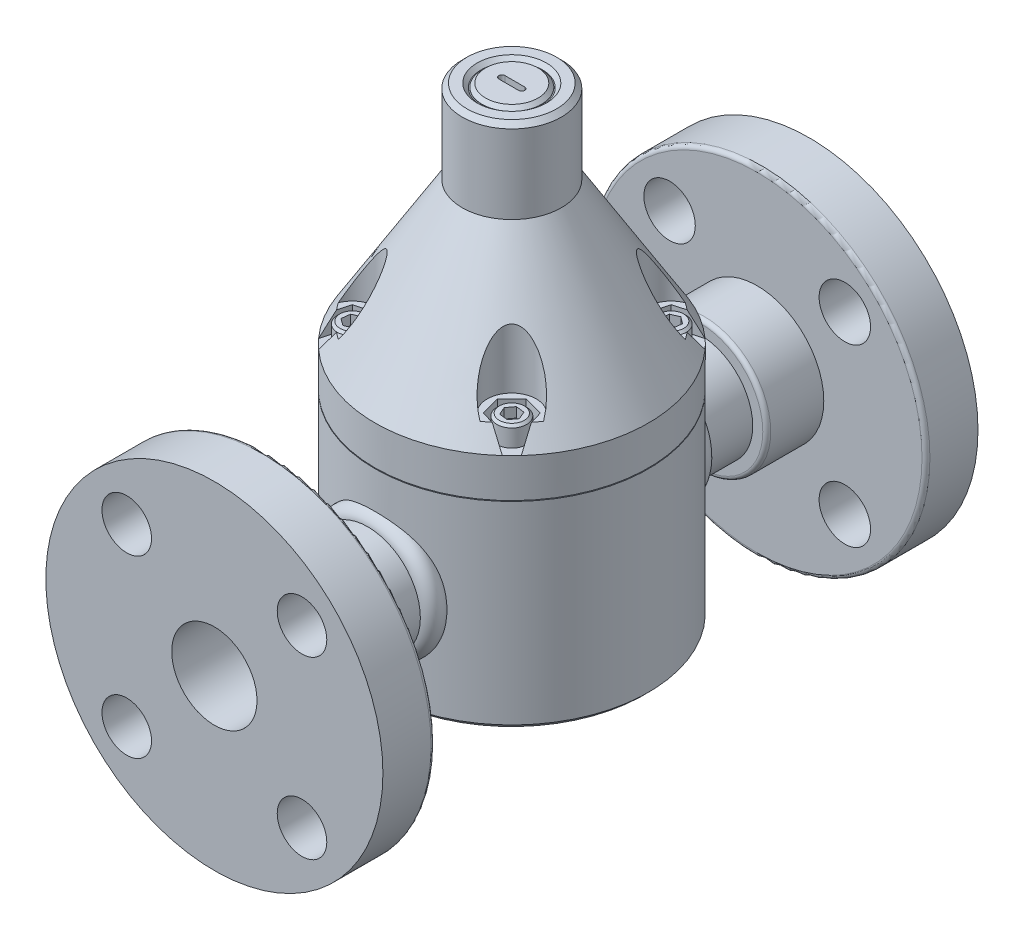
SolidWorks part; units mm, degrees
ref_plane "Front Plane" through (0, 0, 0) normal (0, 0, 1) x (1, 0, 0)
ref_plane "Top Plane" through (0, 0, 0) normal (0, 1, 0) x (1, 0, 0)
ref_plane "Right Plane" through (0, 0, 0) normal (1, 0, 0) x (0, 0, -1)
sketch "Sketch1" plane through (0, 0, 0) normal (0, 1, 0) x (1, 0, 0)
  circle A0 centre (0, 0) radius 43.815
  dimension "D1" = 87.63
extrude "Extrude1" add sketch "Sketch1" along normal blind 148.59
sketch "Sketch2" plane through (0, 0, 0) normal (0, 0, 1) x (1, 0, 0)
  line L0 (0, 148.59) -> (0, 0) construction
  line L1 (43.815, 148.59) -> (-43.815, 148.59) construction
  line L2 (-52.6288, 63.5) -> (-30.226, 63.5)
  line L4 (-30.226, 63.5) -> (-30.226, 63.754)
  line L5 (-30.226, 63.754) -> (-43.815, 63.754)
  line L7 (-43.815, 63.754) -> (-43.815, 76.2)
  line L8 (-43.815, 76.2) -> (-15.875, 121.92)
  line L9 (-15.875, 121.92) -> (-15.875, 152.4)
  line L10 (-15.875, 152.4) -> (-52.6288, 152.4)
  line L11 (-52.6288, 152.4) -> (-52.6288, 63.5)
  line L12 (-43.815, 0) -> (43.815, 0) construction
  dimension "D1" = 43.815
  dimension "D2" = 15.875
  dimension "D3" = 63.5
  dimension "D4" = 30.226
  dimension "D5" = 0.254
  dimension "D6" = 76.2
  dimension "D7" = 152.4
  dimension "D8" = 121.92
revolve "Cut-Revolve1" cut sketch "Sketch2" angle 360 about L0
chamfer "Chamfer1" distance 1.524 angle 45 2 edges at (0, 0, 43.815) (0, 148.59, 15.875)
ref_plane "Plane1" through (0, 148.59, 0) normal (0, 1, 0) x (-1, 0, 0)
sketch "Sketch3" plane through (0, 148.59, 0) normal (0, 1, 0) x (-1, 0, 0)
  circle A0 centre (0, 0) radius 11.1125
  dimension "D1" = 22.225
extrude "Extrude2" cut sketch "Sketch3" against normal blind 1.27 draft 45
sketch "Sketch4" plane through (0, 148.59, 0) normal (0, 1, 0) x (-1, 0, 0)
  circle A0 centre (0, 0) radius 9.525
  dimension "D1" = 19.05
extrude "Extrude3" add sketch "Sketch4" against normal up to surface (1.27 mm away)
chamfer "Chamfer2" distance 1.143 angle 45 1 edges at (0, 148.59, 9.525)
sketch "Sketch5" plane through (0, 148.59, 0) normal (0, 1, 0) x (-1, 0, 0)
  line L0 (3.175, 0) -> (-3.175, 0) construction
  line L1 (3.175, 0.9652) -> (-3.175, 0.9652)
  line L2 (-3.175, -0.9652) -> (3.175, -0.9652)
  arc A0 (-3.175, 0.9652) -> (-3.175, -0.9652) centre (-3.175, 0) ccw
  arc A1 (3.175, -0.9652) -> (3.175, 0.9652) centre (3.175, 0) ccw
  dimension "D1" = 3.175
  dimension "D2" = 6.35
  dimension "D3" = 0.9652
  dimension "D4" = 0.9652
extrude "Extrude4" cut sketch "Sketch5" against normal blind 3.175 draft 1
ref_plane "Plane2" through (0, 82.55, 0) normal (0, 1, 0) x (-1, 0, 0)
sketch "Sketch6" plane through (0, 82.55, 0) normal (0, 1, 0) x (-1, 0, 0)
  line L0 (0, 0) -> (-30.9819, 30.9819) construction
  circle A0 centre (0, 0) radius 36.0934 construction
  circle A1 centre (0, 0) radius 43.815 construction
  circle A2 centre (-25.5219, 25.5219) radius 7.874
  dimension "D1" = 15.748
extrude "Extrude5" cut sketch "Sketch6" along normal blind 22.86
sketch "Sketch7" plane through (0, 82.55, 0) normal (0, 1, 0) x (-1, 0, 0)
  line L0 (0, 0) -> (-25.5219, 25.5219) construction
  line L1 (-25.5219, 25.5219) -> (-31.0896, 19.9541) construction
  line L2 (-25.5219, 25.5219) -> (-19.9541, 31.0896) construction
  line L3 (-25.5219, 25.5219) -> (-39.3911, 39.3911) construction
  line L4 (-30.0845, 20.9593) -> (-23.8519, 19.2893)
  line L5 (-23.8519, 19.2893) -> (-19.2893, 23.8519)
  line L6 (-19.2893, 23.8519) -> (-20.9593, 30.0845)
  line L10 (-30.0845, 20.9593) -> (-33.6536, 33.6536)
  line L11 (-33.6536, 33.6536) -> (-20.9593, 30.0845)
  line L13 (-27.1919, 31.7545) -> (-31.7545, 27.1919)
  line L14 (-20.9593, 30.0845) -> (-27.1919, 31.7545)
  line L15 (-31.7545, 27.1919) -> (-30.0845, 20.9593)
  arc A0 (-32.8666, 22.6837) -> (-22.6837, 32.8666) centre (-25.5219, 25.5219) ccw construction
  circle A1 centre (-25.5219, 25.5219) radius 5.588 construction
extrude "Extrude6" cut sketch "Sketch7" against normal blind 6.35
sketch "Sketch8" plane through (0, 82.55, 0) normal (0, 1, 0) x (-1, 0, 0)
  circle A0 centre (-25.5219, 25.5219) radius 4.7625
  dimension "D1" = 9.525
extrude "Extrude7" add sketch "Sketch8" against normal up to surface (6.35 mm away)
sketch "Sketch9" plane through (0, 82.55, 0) normal (0, 1, 0) x (-1, 0, 0)
  line L1 (-23.8739, 27.7452) -> (-26.6233, 28.0608)
  line L2 (-26.6233, 28.0608) -> (-28.2713, 25.8375)
  line L3 (-28.2713, 25.8375) -> (-27.1699, 23.2986)
  line L4 (-27.1699, 23.2986) -> (-24.4205, 22.983)
  line L5 (-24.4205, 22.983) -> (-22.7725, 25.2063)
  line L6 (-22.7725, 25.2063) -> (-23.8739, 27.7452)
  circle A0 centre (-25.5219, 25.5219) radius 2.3967 construction
extrude "Extrude8" cut sketch "Sketch9" against normal blind 3.175
pattern_circular "CirPattern1" count 4 over 360 about axis through (0, 0, 0) along (0, 1, 0) of "Extrude5", "Extrude6", "Extrude7", "Extrude8"
chamfer "Chamfer3" distance 0.762 angle 45 4 edges at (25.5219, 82.55, 30.2844) (30.2844, 82.55, -25.5219) (-25.5219, 82.55, -30.2844) (-30.2844, 82.55, 25.5219)
ref_plane "Plane3" through (0, 0, 95.25) normal (0, 0, 1) x (1, 0, 0)
sketch "Sketch10" plane through (0, 0, 95.25) normal (0, 0, 1) x (1, 0, 0)
  line L0 (0, 0) -> (0, 148.59) construction
  line L2 (-3.175, 148.59) -> (3.175, 148.59) construction
  line L3 (43.815, 31.75) -> (-43.815, 31.75) construction
  line L4 (43.815, 1.524) -> (43.815, 63.5) construction
  line L5 (-43.815, 63.5) -> (-43.815, 1.524) construction
  line L6 (-42.291, 0) -> (42.291, 0) construction
  circle A0 centre (0, 31.75) radius 53.975
  dimension "D2" = 107.95
  dimension "D1" = 31.75
extrude "Boss-Extrude1" add sketch "Sketch10" against normal blind 16.6624 separate body
sketch "Sketch11" plane through (0, 0, 95.25) normal (0, 0, 1) x (1, 0, 0)
  circle A0 centre (0, 31.75) radius 21.4249
  dimension "D1" = 42.8498
extrude "Boss-Extrude2" add sketch "Sketch11" against normal blind 34.925
sketch "Sketch12" plane through (0, 0, 95.25) normal (0, 0, 1) x (1, 0, 0)
  circle A0 centre (0, 31.75) radius 16.8275
  dimension "D1" = 33.655
extrude "Boss-Extrude3" add sketch "Sketch12" against normal up to surface (54.7952 mm away)
sketch "Sketch13" plane through (0, 0, 95.25) normal (0, 0, 1) x (1, 0, 0)
  line L0 (0, 31.75) -> (-53.975, 31.75) construction
  line L1 (0, 31.75) -> (-38.1661, 69.9161) construction
  circle A0 centre (0, 31.75) radius 53.975 construction
  circle A1 centre (0, 31.75) radius 39.6875 construction
  circle A2 centre (-28.0633, 59.8133) radius 7.9375
  dimension "D2" = 79.375
  dimension "D3" = 15.875
  dimension "D1" = 45
extrude "Cut-Extrude1" cut sketch "Sketch13" against normal blind 34.925
pattern_circular "CirPattern3" count 4 over 360 about axis through (0, 31.75, 0) along (0, 0, 1) of "Cut-Extrude1"
sketch "Sketch14" plane through (0, 0, 95.25) normal (0, 0, 1) x (1, 0, 0)
  circle A0 centre (0, 31.75) radius 13.6525
  dimension "D1" = 27.305
extrude "Cut-Extrude2" cut sketch "Sketch14" against normal blind 25.4
ref_plane "Plane4" through (0, 0, -95.25) normal (0, 0, 1) x (1, 0, 0)
sketch "Sketch15" plane through (0, 0, -95.25) normal (0, 0, 1) x (1, 0, 0)
  circle A0 centre (0, 31.75) radius 54.0468
extrude "Boss-Extrude4" add sketch "Sketch15" along normal blind 16.6624 separate body
sketch "Sketch16" plane through (0, 0, -95.25) normal (0, 0, 1) x (1, 0, 0)
  circle A0 centre (0, 31.75) radius 21.3232
extrude "Boss-Extrude5" add sketch "Sketch16" along normal blind 34.925
sketch "Sketch17" plane through (0, 0, -95.25) normal (0, 0, 1) x (1, 0, 0)
  circle A0 centre (0, 31.75) radius 16.8275
extrude "Boss-Extrude6" add sketch "Sketch17" along normal up to surface (54.7952 mm away)
sketch "Sketch18" plane through (0, 0, -95.25) normal (0, 0, 1) x (1, 0, 0)
  circle A0 centre (28.0633, 59.8133) radius 8.2369
extrude "Cut-Extrude3" cut sketch "Sketch18" along normal blind 34.925
pattern_circular "CirPattern4" count 4 over 360 about axis through (0, 31.75, 0) along (0, 0, 1) of "Cut-Extrude3"
fillet "Fillet1" radius 1.27 4 edges at (54.0468, 31.75, -78.5876) (21.3232, 31.75, -60.325) (21.4249, 31.75, 60.325) (53.975, 31.75, 78.5876)
sketch "Sketch19" plane through (0, 0, 0) normal (1, 0, 0) x (0, 0, -1)
  line L0 (-46.147, 46.3279) -> (-46.147, 48.2109)
  line L2 (-38.7005, 48.5533) -> (-38.7005, 44.2737)
  line L3 (-38.7005, 44.2737) -> (-46.147, 46.3279)
  line L4 (-59.3637, 31.8439) -> (0, 31.8439) construction
  arc A0 (-46.147, 48.2109) -> (-38.7005, 48.5533) centre (-42.4159, 48.2109) cw
revolve "Revolve1" add sketch "Sketch19" angle 360 about L4
mirror "Mirror2" about plane through (0, 0, 0) normal (0, 0, 1) of "Revolve1"
